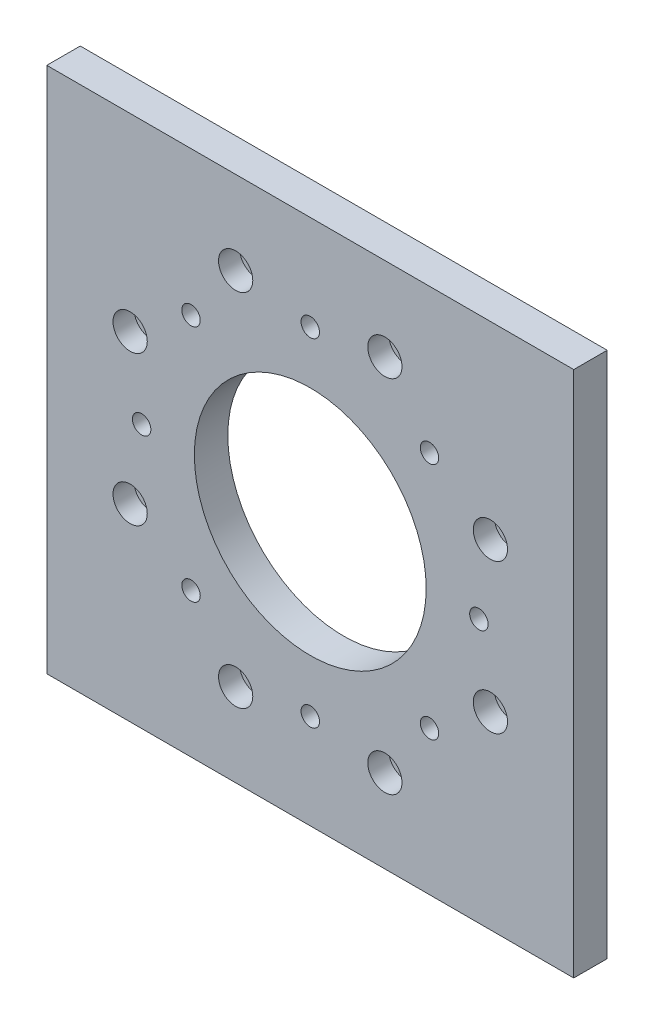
SolidWorks part; units mm, degrees
ref_plane "Front Plane" through (0, 0, 0) normal (1, 0, 0) x (0, 1, 0)
ref_plane "Top Plane" through (0, 0, 0) normal (0, 0, 1) x (0, 1, 0)
ref_plane "Right Plane" through (0, 0, 0) normal (0, 1, 0) x (-1, 0, 0)
sketch "Sketch2" plane through (0, 0, 0) normal (0, 0, 1) x (0, 1, 0)
  line L1 (-50, 50) -> (50, 50)
  line L2 (-50, 50) -> (-50, -50)
  line L3 (-50, -50) -> (50, -50)
  line L4 (50, 50) -> (50, -50)
  line L5 (-50, 50) -> (50, -50) construction
  line L6 (-50, -50) -> (50, 50) construction
  point P0 (0, 0)
  dimension "D1" = 100
  dimension "D2" = 100
extrude "Placa" add sketch "Sketch2" along normal blind 6.35
sketch "Sketch3" plane through (0, 0, 6.35) normal (0, 0, 1) x (1, 0, 0)
  line L0 (0, 0) -> (32, 0) construction
  circle A0 centre (32, 0) radius 1.75
  circle A1 centre (22.6274, -22.6274) radius 1.75
  circle A2 centre (0, -32) radius 1.75
  circle A3 centre (-22.6274, -22.6274) radius 1.75
  circle A4 centre (-32, 0) radius 1.75
  circle A5 centre (-22.6274, 22.6274) radius 1.75
  circle A6 centre (0, 32) radius 1.75
  circle A7 centre (22.6274, 22.6274) radius 1.75
  dimension "D2" = 3.5
  dimension "D1" = 32
  dimension "D3" = 8
extrude "Barrenos_rodamiento" cut sketch "Sketch3" against normal through all
sketch "Sketch4" plane through (0, 0, 6.35) normal (0, 0, 1) x (1, 0, 0)
  circle A0 centre (0, 0) radius 22
  dimension "D1" = 44
extrude "Barrenos_central_motor" cut sketch "Sketch4" against normal through all
sketch "Sketch5" plane through (0, 0, 6.35) normal (0, 0, 1) x (1, 0, 0)
  line L0 (0, 0) -> (34.1835, 14.1593) construction
  line L1 (0, 0) -> (32, 0) construction
  circle A0 centre (34.1835, 14.1593) radius 1.5
  circle A1 centre (34.1835, -14.1593) radius 1.5
  circle A2 centre (14.1593, -34.1835) radius 1.5
  circle A3 centre (-14.1593, -34.1835) radius 1.5
  circle A4 centre (-34.1835, -14.1593) radius 1.5
  circle A5 centre (-34.1835, 14.1593) radius 1.5
  circle A6 centre (-14.1593, 34.1835) radius 1.5
  circle A7 centre (14.1593, 34.1835) radius 1.5
  dimension "D2" = 3
  dimension "D1" = 37
  dimension "D3" = 22.5
  dimension "D4" = 8
extrude "Barrenos_sujecion_motor" cut sketch "Sketch5" against normal through all
sketch "Sketch6" plane through (0, 0, 6.35) normal (0, 0, 1) x (0, -1, 0)
  line L0 (-14.1593, 34.1835) -> (0, 0) construction
  circle A0 centre (-14.1593, 34.1835) radius 3.25
  circle A1 centre (14.1593, 34.1835) radius 3.25
  circle A2 centre (34.1835, 14.1593) radius 3.25
  circle A3 centre (34.1835, -14.1593) radius 3.25
  circle A4 centre (14.1593, -34.1835) radius 3.25
  circle A5 centre (-14.1593, -34.1835) radius 3.25
  circle A6 centre (-34.1835, -14.1593) radius 3.25
  circle A7 centre (-34.1835, 14.1593) radius 3.25
  dimension "D1" = 6.5
  dimension "D2" = 8
extrude "Cut-Extrude1" cut sketch "Sketch6" against normal blind 4
